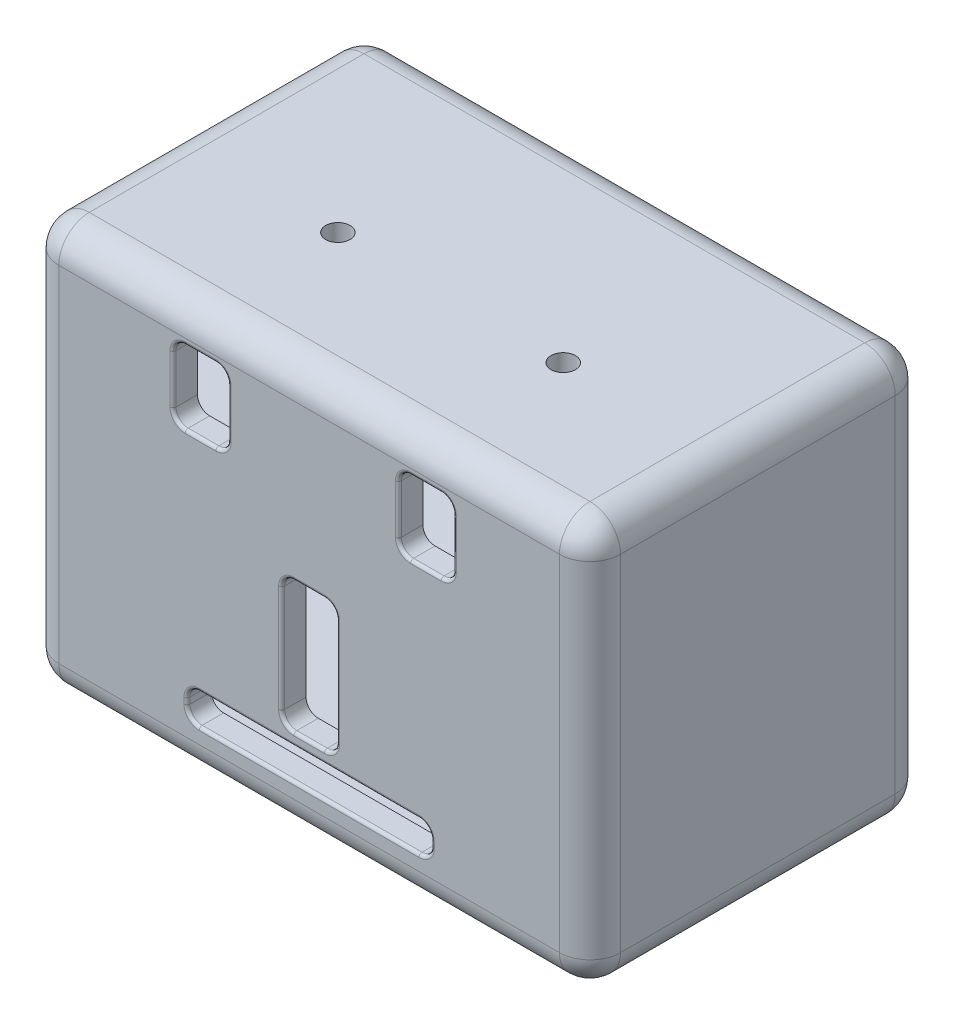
SolidWorks part; units mm, degrees
ref_plane "Front Plane" through (0, 0, 0) normal (0, 0, 1) x (1, 0, 0)
ref_plane "Top Plane" through (0, 0, 0) normal (0, 1, 0) x (1, 0, 0)
ref_plane "Right Plane" through (0, 0, 0) normal (1, 0, 0) x (0, 0, -1)
body saved out of another part "Stock-Calendar Test Model-1"
fillet "Fillet1" radius 0.5 32 edges at (19.4142, -26.5858, 27.5) (20, -28.5, 27.5) (19.4142, -30.4142, 27.5) (0, -31, 27.5) (-19.4142, -30.4142, 27.5) (-20, -28.5, 27.5) (-19.4142, -26.5858, 27.5) (-3.9142, -3.0858, 27.5) (0, -2.5, 27.5) (3.9142, -3.0858, 27.5) (4.5, -13.25, 27.5) (3.9142, -23.4142, 27.5) (0, -24, 27.5) (-3.9142, -23.4142, 27.5) (15.212, 10.5858, 27.5) (14.6262, 16, 27.5) (15.212, 21.4142, 27.5) (19.1262, 22, 27.5) (23.0404, 21.4142, 27.5) (23.6262, 16, 27.5) (23.0404, 10.5858, 27.5) (-17.7868, 10, 27.5) (-13.8726, 10.5858, 27.5) (-13.2868, 16, 27.5) (-13.8726, 21.4142, 27.5) (-17.7868, 22, 27.5) (-21.701, 21.4142, 27.5) (-22.2868, 16, 27.5) (0, -26, 27.5) (-4.5, -13.25, 27.5) (19.1262, 10, 27.5) (-21.701, 10.5858, 27.5)
